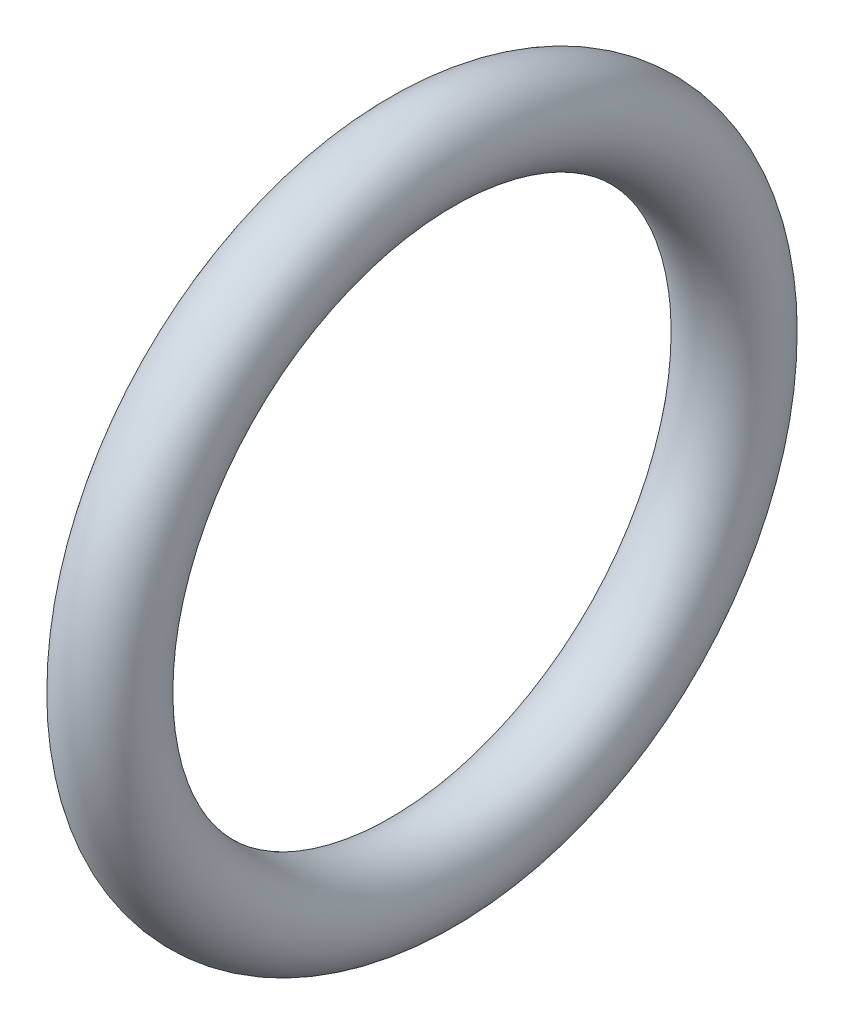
SolidWorks part; units mm, degrees
ref_plane "Plan de face" through (0, 0, 0) normal (0, 0, 1) x (1, 0, 0)
ref_plane "Plan de dessus" through (0, 0, 0) normal (0, 1, 0) x (1, 0, 0)
ref_plane "Plan de droite" through (0, 0, 0) normal (1, 0, 0) x (0, 0, -1)
sketch "Esquisse1" plane through (0, 0, 0) normal (0, 0, 1) x (1, 0, 0)
  line L0 (-5.3489, 0) -> (4.8795, 0) construction
  circle A0 centre (0, 7) radius 1
  dimension "D1" = 2
  dimension "D2" = 7
revolve "Révolution1" add sketch "Esquisse1" angle 360 about L0
